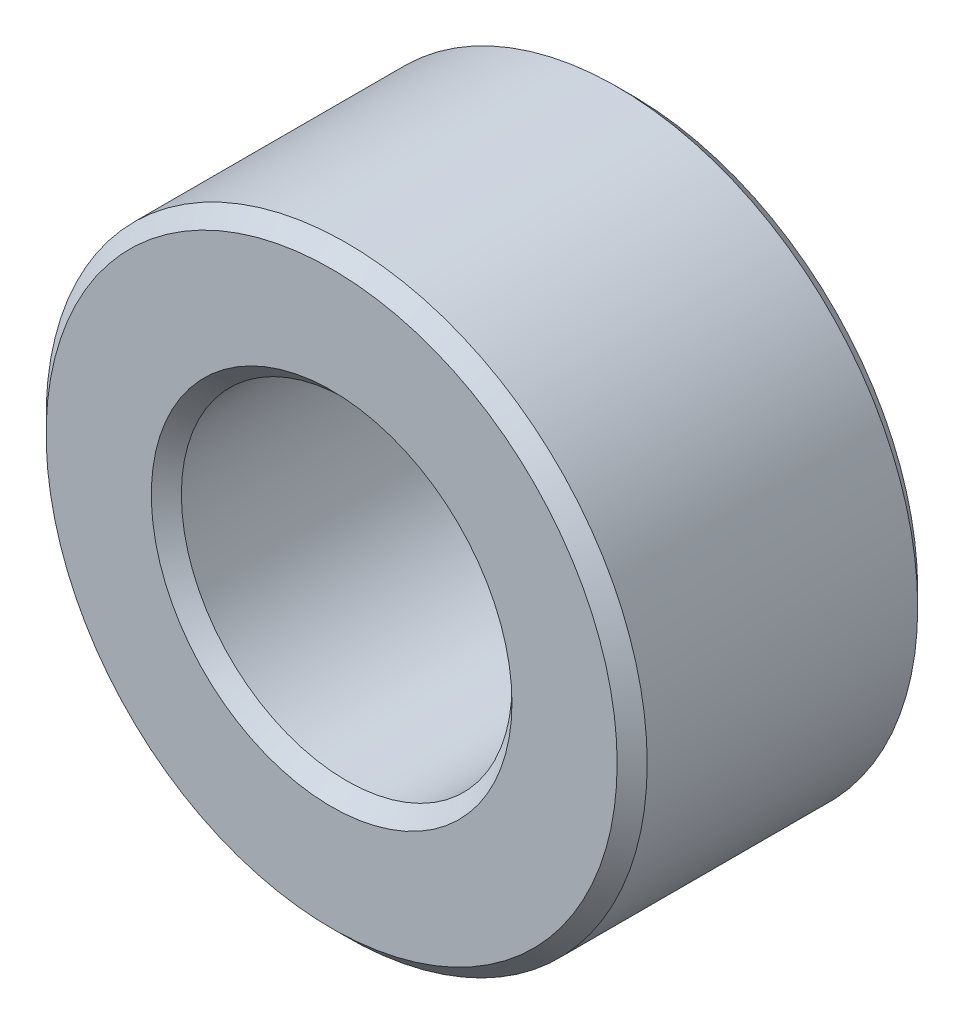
SolidWorks part; units mm, degrees
ref_plane "Front Plane" through (0, 0, 0) normal (0, 0, 1) x (1, 0, 0)
ref_plane "Top Plane" through (0, 0, 0) normal (0, 1, 0) x (1, 0, 0)
ref_plane "Right Plane" through (0, 0, 0) normal (1, 0, 0) x (0, 0, -1)
sketch "Sketch1" plane through (0, 0, 0) normal (0, 0, 1) x (1, 0, 0)
  circle A0 centre (0, 0) radius 2
  circle A1 centre (0, 0) radius 1.1
  dimension "D1" = 4
  dimension "D2" = 2.2
extrude "Boss-Extrude2" add sketch "Sketch1" along normal mid plane 2
chamfer "Chamfer3" distance 0.1 angle 45 4 edges at (2, 0, 1) (2, 0, -1) (1.1, 0, -1) (1.1, 0, 1)
